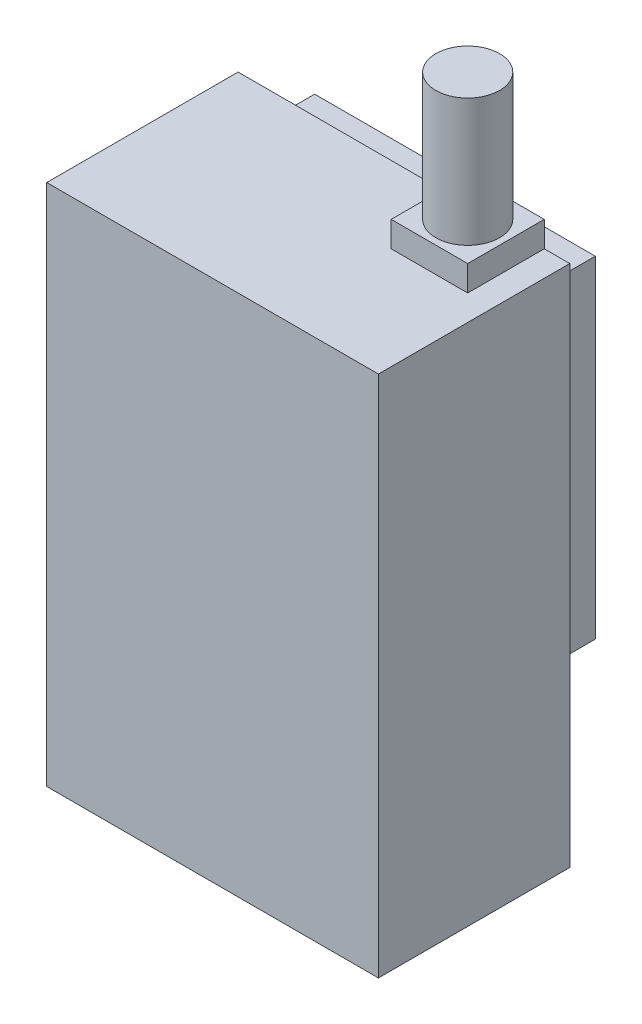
SolidWorks part; units mm, degrees
ref_plane "Alzado" through (0, 0, 0) normal (0, 0, 1) x (1, 0, 0)
ref_plane "Planta" through (0, 0, 0) normal (0, 1, 0) x (1, 0, 0)
ref_plane "Vista lateral" through (0, 0, 0) normal (1, 0, 0) x (0, 0, -1)
sketch "Croquis1" plane through (0, 0, 0) normal (0, 0, 1) x (1, 0, 0)
  line L1 (-29.3201, 32.6998) -> (-3.3201, 32.6998)
  line L2 (-29.3201, 32.6998) -> (-29.3201, -8.3002)
  line L3 (-29.3201, -8.3002) -> (-3.3201, -8.3002)
  line L4 (-3.3201, 32.6998) -> (-3.3201, -8.3002)
  line L5 (-29.3201, 32.6998) -> (-3.3201, -8.3002) construction
  line L6 (-29.3201, -8.3002) -> (-3.3201, 32.6998) construction
  point P0 (-16.3201, 12.1998)
  dimension "D1" = 41
  dimension "D2" = 26
extrude "Saliente-Extruir1" add sketch "Croquis1" along normal blind 15
sketch "Croquis2" plane through (0, 0, 0) normal (0, 0, -1) x (-1, 0, 0)
  line L0 (29.3201, 32.6998) -> (29.3201, -8.3002) construction
  line L1 (26.3201, 31.1998) -> (4.3201, 31.1998)
  line L2 (26.3201, 31.1998) -> (26.3201, 5.1998)
  line L3 (26.3201, 5.1998) -> (4.3201, 5.1998)
  line L4 (4.3201, 31.1998) -> (4.3201, 5.1998)
  line L5 (26.3201, 31.1998) -> (4.3201, 5.1998) construction
  line L6 (26.3201, 5.1998) -> (4.3201, 31.1998) construction
  line L7 (3.3201, 32.6998) -> (29.3201, 32.6998) construction
  line L8 (3.3201, -8.3002) -> (3.3201, 32.6998) construction
  point P0 (15.3201, 18.1998)
  dimension "D1" = 22
  dimension "D2" = 26
  dimension "D3" = 3
  dimension "D4" = 1.5
  dimension "D5" = 1
extrude "Saliente-Extruir2" add sketch "Croquis2" along normal blind 3
sketch "Croquis5" plane through (0, 32.6998, 0) normal (0, 1, 0) x (-1, 0, 0)
  line L0 (3.3201, 0) -> (29.3201, 0) construction
  line L1 (5.3201, 6) -> (11.3201, 6)
  line L2 (5.3201, 6) -> (5.3201, 0)
  line L3 (5.3201, 0) -> (11.3201, 0)
  line L4 (11.3201, 6) -> (11.3201, 0)
  line L5 (5.3201, 6) -> (11.3201, 0) construction
  line L6 (5.3201, 0) -> (11.3201, 6) construction
  line L7 (3.3201, 15) -> (3.3201, 0) construction
  point P0 (8.3201, 3)
  dimension "D1" = 6
  dimension "D2" = 6
  dimension "D3" = 0
  dimension "D4" = 2
extrude "Saliente-Extruir3" add sketch "Croquis5" along normal blind 2
sketch "Croquis6" plane through (0, 34.6998, 0) normal (0, 1, 0) x (-1, 0, 0)
  line L0 (11.3201, 6) -> (5.3201, 0) construction
  line L1 (5.3201, 0) -> (11.3201, 0) construction
  line L2 (11.3201, 0) -> (5.3201, 6) construction
  line L3 (11.3201, 6) -> (5.3201, 6) construction
  line L4 (5.3201, 6) -> (5.3201, 0) construction
  circle A0 centre (8.3201, 3) radius 2.5
  point P14 (8.3201, 3)
extrude "Saliente-Extruir4" add sketch "Croquis6" along normal blind 10
